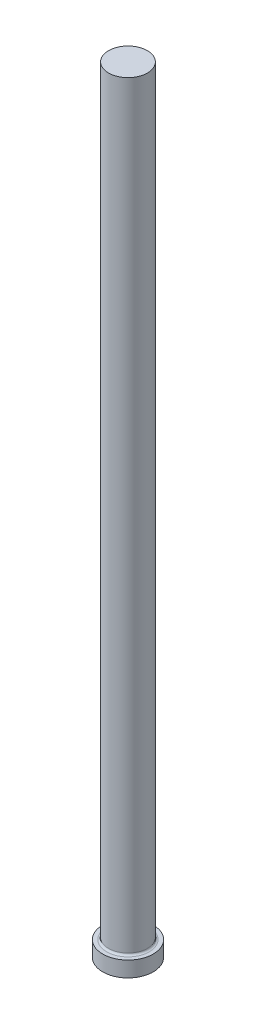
SolidWorks part; units mm, degrees
ref_plane "Plano frontal" through (0, 0, 0) normal (0, 0, 1) x (1, 0, 0)
ref_plane "Plano superior" through (0, 0, 0) normal (0, 1, 0) x (1, 0, 0)
ref_plane "Plano direito" through (0, 0, 0) normal (1, 0, 0) x (0, 0, -1)
sketch "Esboço1" plane through (0, 0, 0) normal (0, 0, 1) x (1, 0, 0)
  line L0 (0, 0) -> (13, 0)
  line L1 (13, 0) -> (13, 8)
  line L2 (13, 8) -> (11, 8)
  line L3 (10, 9) -> (10, 400)
  line L4 (10, 400) -> (0, 400)
  line L5 (0, 400) -> (0, 0) construction
  line L6 (0, 0) -> (0, 400)
  arc A0 (11, 8) -> (10, 9) centre (11, 9) cw
  dimension "D3" = 1
  dimension "D1" = 26
  dimension "D2" = 20
  dimension "D4" = 8
  dimension "D5" = 400
revolve "Revolução1" add sketch "Esboço1" angle 360 about L5
sketch "Esboço2"
  dimension "D1" = 0.975
  dimension "D2" = 2.275
  dimension "D3" = 1.4625
  dimension "D4" = 6.9875
wrap "Envolver1" sketch "Esboço2" wrap type deboss source sketch "Esboço2" thickness 0.1 parameters "D1"=0.1
